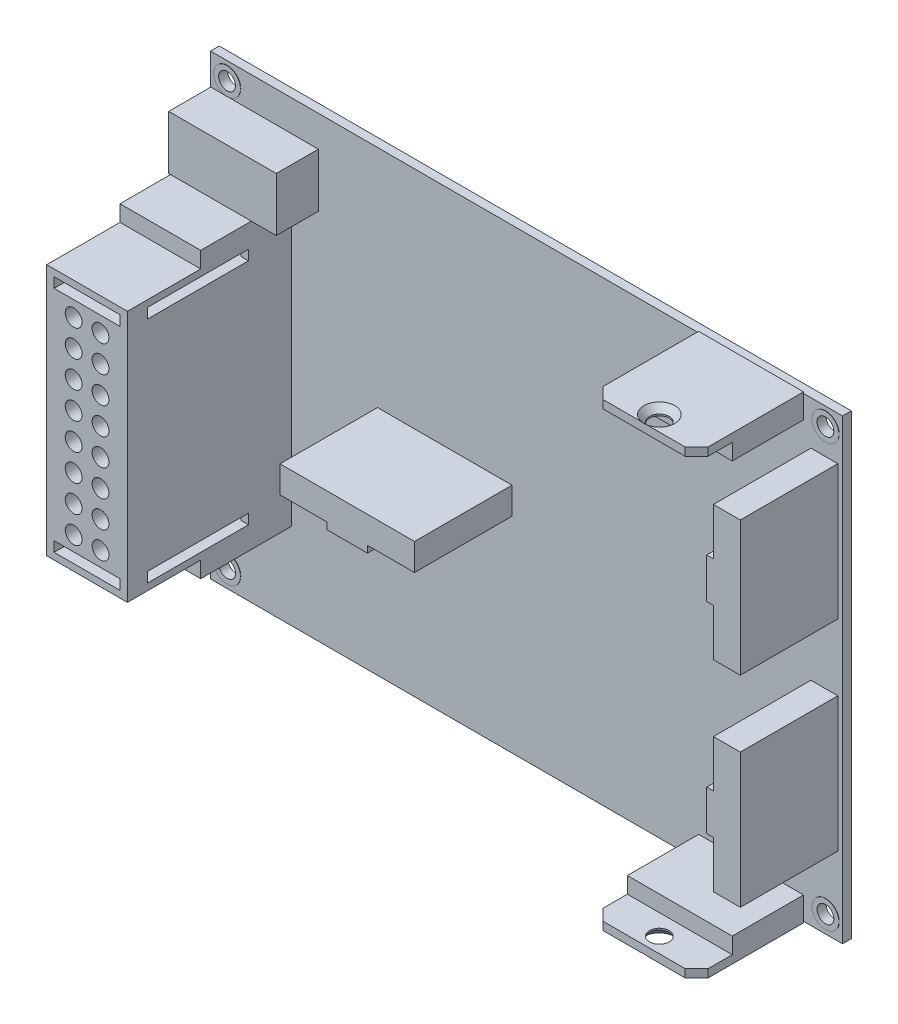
SolidWorks part; units mm, degrees
ref_plane "Front" through (0, 0, 0) normal (0, 0, 1) x (1, 0, 0)
ref_plane "Top" through (0, 0, 0) normal (0, 1, 0) x (1, 0, 0)
ref_plane "Right" through (0, 0, 0) normal (1, 0, 0) x (0, 0, -1)
sketch "Sketch1" plane through (0, 0, 0) normal (0, 0, 1) x (1, 0, 0)
  line L0 (-59.69, -43.18) -> (59.69, 43.18) construction
  line L1 (-59.69, 43.18) -> (59.69, 43.18)
  line L2 (-59.69, 43.18) -> (-59.69, -43.18)
  line L3 (-59.69, -43.18) -> (59.69, -43.18)
  line L4 (59.69, 43.18) -> (59.69, -43.18)
  dimension "D1" = 86.36
  dimension "D2" = 119.38
extrude "Base-Extrude" add sketch "Sketch1" against normal blind 1.651
sketch "Sketch2" plane through (0, 0, 0) normal (0, 0, 1) x (1, 0, 0)
  line L1 (-59.6392, 26.797) -> (-44.3992, 26.797)
  line L2 (-59.6392, 26.797) -> (-59.6392, -26.924)
  line L3 (-59.6392, -26.924) -> (-44.3992, -26.924)
  line L4 (-44.3992, 26.797) -> (-44.3992, -26.924)
  line L5 (59.69, 43.18) -> (-59.69, 43.18) construction
  line L7 (-59.69, 43.18) -> (-59.69, -43.18) construction
  dimension "D1" = 16.383
  dimension "D2" = 15.24
  dimension "D3" = 53.721
  dimension "D4" = 0.0508
extrude "Boss-Extrude1" add sketch "Sketch2" along normal blind 30.988
sketch "Sketch3" plane through (0, 0, 0) normal (0, 0, 1) x (1, 0, 0)
  line L0 (-64.3841, 0) -> (63.9524, 0) construction
  line L1 (0, 48.7017) -> (0, -46.8313) construction
  circle A0 centre (-56.515, 39.878) radius 1.5875
  circle A1 centre (56.515, 39.878) radius 1.5875
  circle A2 centre (56.515, -39.878) radius 1.5875
  circle A3 centre (-56.515, -39.878) radius 1.5875
  dimension "D3" = 3.175
  dimension "D1" = 79.756
  dimension "D2" = 113.03
extrude "Cut-Extrude1" cut sketch "Sketch3" against normal through all
sketch "Sketch4" plane through (0, 0, 0) normal (0, 0, 1) x (1, 0, 0)
  line L1 (-59.6392, 37.3126) -> (-39.3192, 37.3126)
  line L2 (-59.6392, 37.3126) -> (-59.6392, 27.1526)
  line L3 (-59.6392, 27.1526) -> (-39.3192, 27.1526)
  line L4 (-39.3192, 37.3126) -> (-39.3192, 27.1526)
  line L5 (59.69, 43.18) -> (-59.69, 43.18) construction
  line L6 (-59.69, 43.18) -> (-59.69, -43.18) construction
  dimension "D1" = 5.8674
  dimension "D2" = 10.16
  dimension "D3" = 20.32
  dimension "D4" = 0.0508
extrude "Boss-Extrude2" add sketch "Sketch4" along normal blind 7.9502
sketch "Sketch5" plane through (0, 0, 0) normal (0, 0, 1) x (1, 0, 0)
  line L0 (-59.69, -43.18) -> (59.69, -43.18) construction
  line L1 (-28.1432, 0.635) -> (-2.7432, 0.635)
  line L2 (-28.1432, 0.635) -> (-28.1432, -4.445)
  line L3 (-28.1432, -4.445) -> (-2.7432, -4.445)
  line L4 (-2.7432, 0.635) -> (-2.7432, -4.445)
  line L5 (-44.3992, -26.924) -> (-44.3992, 26.797) construction
  dimension "D1" = 5.08
  dimension "D2" = 25.4
  dimension "D3" = 38.735
  dimension "D4" = 16.256
extrude "Boss-Extrude3" add sketch "Sketch5" along normal blind 18.415
sketch "Sketch6" plane through (0, 0, 0) normal (0, 0, 1) x (1, 0, 0)
  line L0 (59.69, 43.18) -> (-59.69, 43.18) construction
  line L1 (32.512, 43.434) -> (52.324, 43.434)
  line L2 (32.512, 43.434) -> (32.512, 38.862)
  line L3 (32.512, 38.862) -> (52.324, 38.862)
  line L4 (52.324, 43.434) -> (52.324, 38.862)
  line L5 (59.69, -43.18) -> (59.69, 43.18) construction
  line L6 (62.9453, 0) -> (0, 0) construction
  line L7 (52.324, -43.434) -> (52.324, -38.862)
  line L8 (32.512, -38.862) -> (52.324, -38.862)
  line L9 (32.512, -43.434) -> (32.512, -38.862)
  line L10 (32.512, -43.434) -> (52.324, -43.434)
  dimension "D1" = 4.572
  dimension "D2" = 19.812
  dimension "D3" = 7.366
  dimension "D4" = 0.254
extrude "Boss-Extrude4" add sketch "Sketch6" along normal blind 13.462
sketch "Sketch7" plane through (0, 0, 13.462) normal (0, 0, 1) x (1, 0, 0)
  line L0 (52.324, 38.862) -> (52.324, 43.434) construction
  line L1 (32.512, 43.434) -> (52.324, 43.434)
  line L2 (32.512, 43.434) -> (32.512, 41.91)
  line L3 (32.512, 41.91) -> (52.324, 41.91)
  line L4 (52.324, 43.434) -> (52.324, 41.91)
  line L5 (2.6617, 0) -> (62.3698, 0) construction
  line L6 (52.324, -43.434) -> (52.324, -41.91)
  line L7 (32.512, -41.91) -> (52.324, -41.91)
  line L8 (32.512, -43.434) -> (32.512, -41.91)
  line L9 (32.512, -43.434) -> (52.324, -43.434)
  dimension "D1" = 1.524
extrude "Boss-Extrude5" add sketch "Sketch7" along normal blind 6.731
sketch "Sketch8" plane through (0, 0, 0) normal (0, 0, 1) x (1, 0, 0)
  line L0 (59.69, -43.18) -> (59.69, 43.18) construction
  line L1 (53.721, 34.925) -> (58.801, 34.925)
  line L2 (53.721, 34.925) -> (53.721, 9.525)
  line L3 (53.721, 9.525) -> (58.801, 9.525)
  line L4 (58.801, 34.925) -> (58.801, 9.525)
  line L5 (59.69, 43.18) -> (52.324, 43.18) construction
  dimension "D1" = 5.08
  dimension "D2" = 25.4
  dimension "D3" = 0.889
  dimension "D4" = 8.255
extrude "Boss-Extrude6" add sketch "Sketch8" along normal blind 18.415
sketch "Sketch16" plane through (0, 0, 18.415) normal (0, 0, 1) x (1, 0, 0)
  line L0 (58.801, 22.225) -> (45.0882, 22.225) construction
  line L1 (58.801, 9.525) -> (58.801, 34.925) construction
  line L2 (53.721, 26.035) -> (53.721, 18.415)
  line L3 (53.721, 18.415) -> (52.451, 18.415)
  line L4 (52.451, 18.415) -> (52.451, 26.035)
  line L5 (53.721, 34.925) -> (53.721, 9.525) construction
  line L6 (53.721, 26.035) -> (52.451, 26.035)
  point P11 (52.451, 22.225)
  point P12 (53.721, 22.225)
  dimension "D1" = 1.27
  dimension "D2" = 7.62
extrude "Boss-Extrude12" add sketch "Sketch16" against normal blind 10.16
sketch "Sketch9" plane through (0, 0, 0) normal (0, 0, 1) x (1, 0, 0)
  line L0 (59.69, -43.18) -> (59.69, 43.18) construction
  line L1 (53.721, -3.048) -> (58.801, -3.048)
  line L2 (53.721, -3.048) -> (53.721, -28.448)
  line L3 (53.721, -28.448) -> (58.801, -28.448)
  line L4 (58.801, -3.048) -> (58.801, -28.448)
  line L5 (52.324, -43.18) -> (59.69, -43.18) construction
  dimension "D1" = 5.08
  dimension "D2" = 25.4
  dimension "D3" = 0.889
  dimension "D4" = 14.732
extrude "Boss-Extrude7" add sketch "Sketch9" along normal blind 18.415
sketch "Sketch17" plane through (3.8541, -36.5579, 18.415) normal (0, 0, 1) x (1, 0, 0)
  line L0 (54.9469, 20.8099) -> (45.0882, 20.8099) construction
  line L2 (49.8669, 24.6199) -> (49.8669, 16.9999)
  line L3 (49.8669, 16.9999) -> (48.5969, 16.9999)
  line L4 (48.5969, 16.9999) -> (48.5969, 24.6199)
  line L6 (49.8669, 24.6199) -> (48.5969, 24.6199)
  line L7 (54.9469, 8.1099) -> (54.9469, 33.5099) construction
  line L8 (49.8669, 33.5099) -> (49.8669, 8.1099) construction
  point P11 (48.5969, 20.8099)
  point P12 (49.8669, 20.8099)
  dimension "D1" = 1.27
  dimension "D2" = 7.62
extrude "Boss-Extrude13" add sketch "Sketch17" against normal blind 10.16
sketch "Sketch10" plane through (0, 0, -1.651) normal (0, 0, -1) x (-1, 0, 0)
  line L0 (-59.69, -43.18) -> (-59.69, 43.18) construction
  line L1 (-52.07, 28.956) -> (-45.72, 28.956)
  line L2 (-52.07, 28.956) -> (-52.07, 25.527)
  line L3 (-52.07, 25.527) -> (-45.72, 25.527)
  line L4 (-45.72, 28.956) -> (-45.72, 25.527)
  line L5 (-59.69, 43.18) -> (59.69, 43.18) construction
  dimension "D1" = 3.429
  dimension "D2" = 6.35
  dimension "D3" = 7.62
  dimension "D4" = 14.224
extrude "Boss-Extrude8" add sketch "Sketch10" along normal blind 2.286
sketch "Sketch18" plane through (0, 0, 18.415) normal (0, 0, 1) x (1, 0, 0)
  line L0 (-15.4432, 0.635) -> (-15.4432, -12.7503) construction
  line L1 (-19.2532, -4.445) -> (-11.6332, -4.445)
  line L2 (-11.6332, -4.445) -> (-11.6332, -5.715)
  line L3 (-11.6332, -5.715) -> (-19.2532, -5.715)
  line L4 (-19.2532, -4.445) -> (-19.2532, -5.715)
  line L5 (-2.7432, 0.635) -> (-28.1432, 0.635) construction
  line L6 (-28.1432, -4.445) -> (-2.7432, -4.445) construction
  point P7 (-15.4432, -4.445)
  dimension "D1" = 1.27
  dimension "D2" = 7.62
extrude "Boss-Extrude14" add sketch "Sketch18" against normal blind 10.16
pattern_linear "LPattern1" count 2 spacing 11.43 count 4 spacing 3.937
sketch "Sketch11" plane through (0, 0, -1.651) normal (0, 0, -1) x (-1, 0, 0)
  line L0 (-50.8, -11.176) -> (-44.45, -11.176)
  line L1 (-50.8, -11.176) -> (-50.8, -14.605)
  line L2 (-50.8, -14.605) -> (-44.45, -14.605)
  line L3 (-44.45, -11.176) -> (-44.45, -14.605)
  line L4 (-59.69, 43.18) -> (59.69, 43.18) construction
  line L5 (-59.69, -43.18) -> (-59.69, 43.18) construction
  dimension "D1" = 54.356
  dimension "D2" = 8.89
  dimension "D3" = 3.429
  dimension "D4" = 6.35
extrude "Boss-Extrude9" add sketch "Sketch11" along normal blind 2.286
pattern_linear "LPattern2" count 2 spacing 10.414 count 4 spacing 4.318
sketch "Sketch12" plane through (0, 0, -1.651) normal (0, 0, -1) x (-1, 0, 0)
  line L0 (59.69, 43.18) -> (59.69, -43.18) construction
  line L1 (-59.69, 43.18) -> (59.69, 43.18) construction
  circle A0 centre (49.53, 17.78) radius 1.27
  dimension "D1" = 2.54
  dimension "D2" = 10.16
  dimension "D3" = 25.4
extrude "Boss-Extrude10" add sketch "Sketch12" along normal blind 2.032
fillet "Fillet1" radius 1.27
pattern_linear "LPattern3" count 2 spacing 5.08 count 8 spacing 5.08
sketch "Sketch13" plane through (0, 0, 0) normal (0, 0, 1) x (1, 0, 0)
  circle A0 centre (-56.515, 39.878) radius 2.54
  circle A1 centre (-56.515, -39.878) radius 2.54
  circle A2 centre (56.515, -39.878) radius 2.54
  circle A3 centre (56.515, 39.878) radius 2.54
  circle A4 centre (-56.515, 39.878) radius 1.5875
  circle A5 centre (-56.515, -39.878) radius 1.5875
  circle A6 centre (56.515, -39.878) radius 1.5875
  circle A7 centre (56.515, 39.878) radius 1.5875
  dimension "D1" = 5.08
  dimension "D2" = 3.175
extrude "Boss-Extrude11" add sketch "Sketch13" along normal blind 0.0508
sketch "Sketch14" plane through (-59.69, 0, 0) normal (-1, 0, 0) x (0, 0, 1)
  line L0 (30.988, -0.0635) -> (-12.9743, -0.0635) construction
  line L1 (30.988, 26.797) -> (30.988, -26.924) construction
  line L2 (17.145, -26.924) -> (17.145, -23.876)
  line L3 (30.988, 26.797) -> (17.145, 26.797)
  line L4 (30.988, 26.797) -> (30.988, 23.749)
  line L5 (30.988, 23.749) -> (17.145, 23.749)
  line L6 (17.145, 26.797) -> (17.145, 23.749)
  line L7 (30.988, -23.876) -> (17.145, -23.876)
  line L8 (30.988, -26.924) -> (30.988, -23.876)
  line L9 (30.988, -26.924) -> (17.145, -26.924)
  dimension "D1" = 13.843
  dimension "D2" = 3.048
extrude "Cut-Extrude2" cut sketch "Sketch14" against normal up to next
sketch "Sketch19" plane through (0, 0, 30.988) normal (0, 0, 1) x (1, 0, 0)
  line L0 (-44.3992, 23.749) -> (-59.6392, 23.749) construction
  line L1 (-58.2422, 22.479) -> (-45.7962, 22.479)
  line L2 (-58.2422, 22.479) -> (-58.2422, 20.574)
  line L3 (-58.2422, 20.574) -> (-45.7962, 20.574)
  line L4 (-45.7962, 22.479) -> (-45.7962, 20.574)
  line L5 (-52.0192, 23.749) -> (-52.0192, 15.3833) construction
  line L6 (-59.6392, -0.0635) -> (-39.0639, -0.0635) construction
  line L7 (-59.6392, 23.749) -> (-59.6392, -23.876) construction
  line L8 (-45.7962, -22.606) -> (-45.7962, -20.701)
  line L9 (-58.2422, -20.701) -> (-45.7962, -20.701)
  line L10 (-58.2422, -22.606) -> (-58.2422, -20.701)
  line L11 (-58.2422, -22.606) -> (-45.7962, -22.606)
  point P8 (-52.0192, 22.479)
  point P17 (-52.0192, -22.606)
  dimension "D1" = 1.27
  dimension "D2" = 12.446
  dimension "D3" = 1.905
extrude "Cut-Extrude3" cut sketch "Sketch19" against normal blind 25.4
sketch "Sketch20" plane through (-59.6392, 0, 0) normal (-1, 0, 0) x (0, 0, 1)
  line L0 (17.145, 23.749) -> (30.988, 23.749) construction
  line L1 (27.178, 22.479) -> (8.128, 22.479)
  line L2 (27.178, 22.479) -> (27.178, 20.574)
  line L3 (27.178, 20.574) -> (8.128, 20.574)
  line L4 (8.128, 22.479) -> (8.128, 20.574)
  line L5 (30.988, 23.749) -> (30.988, -23.876) construction
  line L6 (30.988, -0.0635) -> (-4.419, -0.0635) construction
  line L7 (8.128, -22.606) -> (8.128, -20.701)
  line L8 (27.178, -20.701) -> (8.128, -20.701)
  line L9 (27.178, -22.606) -> (27.178, -20.701)
  line L10 (27.178, -22.606) -> (8.128, -22.606)
  dimension "D1" = 1.905
  dimension "D2" = 1.27
  dimension "D3" = 3.81
  dimension "D4" = 19.05
extrude "Cut-Extrude4" cut sketch "Sketch20" against normal up to surface (15.24 mm away)
sketch "Sketch21" plane through (0, 0, 30.988) normal (0, 0, 1) x (1, 0, 0)
  line L0 (-44.3992, 23.749) -> (-59.6392, 23.749) construction
  line L1 (-44.3992, -23.876) -> (-44.3992, 23.749) construction
  circle A0 centre (-49.4792, 17.653) radius 1.5875
  dimension "D3" = 3.175
  dimension "D1" = 6.096
  dimension "D2" = 5.08
extrude "Cut-Extrude5" cut sketch "Sketch21" against normal blind 25.4
pattern_linear "LPattern4" count 8 spacing 5.08 count 2 spacing 5.08
sketch "Sketch22" plane through (0, 0, 0) normal (0, 0, 1) x (1, 0, 0)
  line L0 (49.9834, -23.1853) -> (49.9834, -6.1513) construction
  line L1 (49.9834, 16.2856) -> (49.9834, 32.4047) construction
  text T0 "<b>SIGNALS</b>" font "Century Gothic" height in points 8
  text T1 "<b>ELEVATOR</b>" font "Century Gothic" height in points 8
  text T2 "<b>RUDDER</b>" font "Century Gothic" height in points 8
extrude "Boss-Extrude15" add sketch "Sketch22" along normal blind 0.0508
sketch "Sketch23" plane through (0, 43.434, 0) normal (0, 1, 0) x (-1, 0, 0)
  line L0 (-42.418, 20.193) -> (-42.418, -23.4115) construction
  line L1 (-52.324, 20.193) -> (-32.512, 20.193) construction
  circle A0 centre (-42.418, 17.3228) radius 1.8542
  dimension "D1" = 3.7084
  dimension "D2" = 1.016
extrude "Cut-Extrude6" cut sketch "Sketch23" against normal through all
chamfer "Chamfer1" distance 2.159 angle 45
sketch "Sketch24" [suppressed] plane through (58.801, 0, 0) normal (1, 0, 0) x (0, 0, -1)
  line L0 (-18.415, 22.225) -> (20.0657, 22.225) construction
  line L1 (-18.415, 9.525) -> (-18.415, 34.925) construction
  line L2 (-18.415, -15.748) -> (18.1045, -15.748) construction
  line L3 (-18.415, -28.448) -> (-18.415, -3.048) construction
  line L4 (-18.034, 41.91) -> (-13.462, 41.91) construction
  line L5 (-18.034, -41.91) -> (-13.462, -41.91) construction
  dimension "D1" = 19.685
  dimension "D2" = 26.162
sketch "Sketch25" plane through (0, 43.434, 0) normal (0, 1, 0) x (-1, 0, 0)
  circle A0 centre (-42.418, 17.3228) radius 2.921
  dimension "D1" = 5.842
extrude "Cut- Mod 1 (countersink)" cut sketch "Sketch25" against normal blind 12.7 draft 41
sketch "Sketch26" plane through (0, -43.434, 0) normal (0, -1, 0) x (1, 0, 0)
  circle A0 centre (42.418, 17.3228) radius 2.921
  dimension "D1" = 5.842
extrude "Cut- Mod 2 (countersink)" cut sketch "Sketch26" against normal blind 12.7 draft 41
